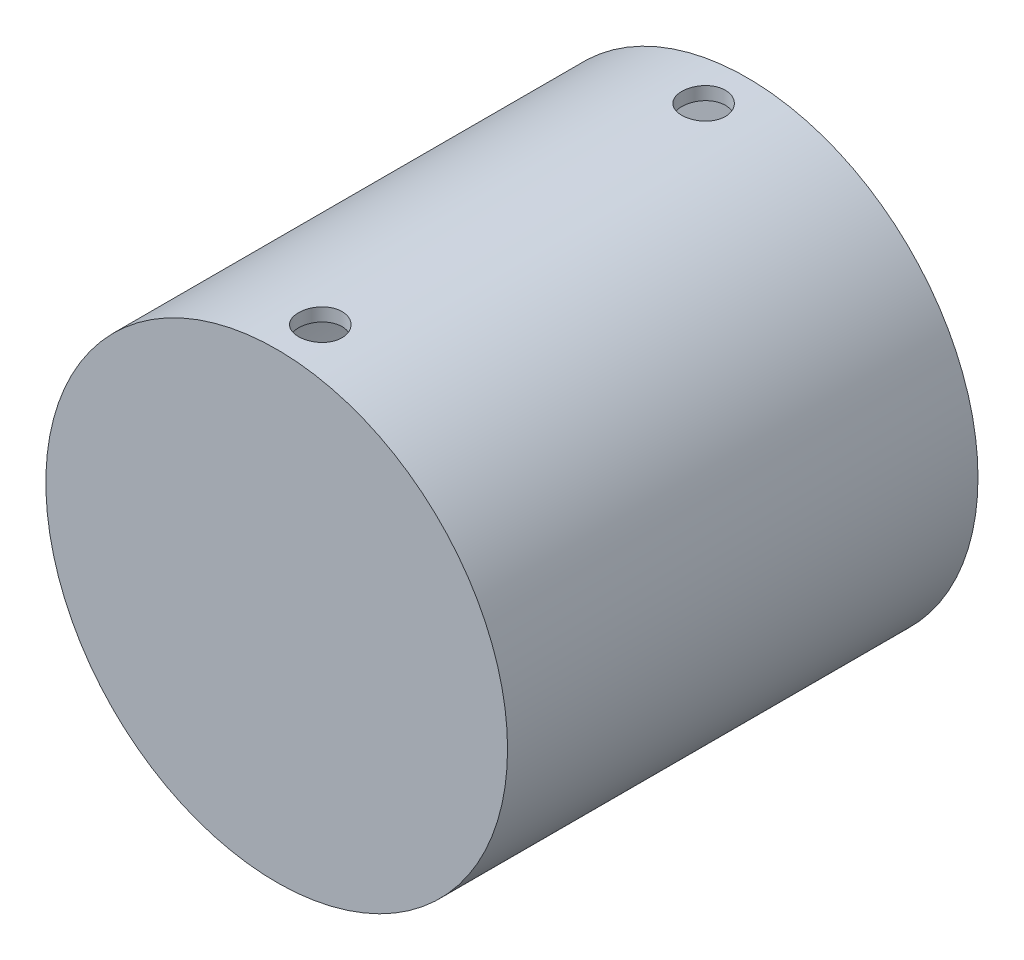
SolidWorks part; units mm, degrees
ref_plane "Front Plane" through (0, 0, 0) normal (0, 0, 1) x (1, 0, 0)
ref_plane "Top Plane" through (0, 0, 0) normal (0, 1, 0) x (1, 0, 0)
ref_plane "Right Plane" through (0, 0, 0) normal (1, 0, 0) x (0, 0, -1)
sketch "Sketch5" plane through (0, 0, 0) normal (0, 0, 1) x (1, 0, 0)
  circle A0 centre (0, 0) radius 50
  circle A1 centre (0, 0) radius 53
  dimension "D1" = 106
  dimension "D2" = 100
extrude "Boss-Extrude5" add sketch "Sketch5" against normal blind 100
sketch "Sketch6" plane through (0, 0, 0) normal (0, 0, 1) x (1, 0, 0)
  circle A0 centre (0, 0) radius 53
extrude "Boss-Extrude6" add sketch "Sketch6" along normal blind 4
ref_plane "Plane3" through (0, 0, -100) normal (0, 0, -1) x (-1, 0, 0)
sketch "Sketch11" plane through (0, 0, -100) normal (0, 0, -1) x (-1, 0, 0)
  circle A0 centre (0, 0) radius 53
  dimension "D1" = 106
extrude "Boss-Extrude9" add sketch "Sketch11" along normal blind 4
sketch "Sketch12" plane through (0, 0, -100) normal (0, 0, -1) x (-1, 0, 0)
  circle A0 centre (0, 0) radius 7.5
  dimension "D1" = 15
extrude "Cut-Extrude4" cut sketch "Sketch12" along normal blind 18
sketch "Sketch13" plane through (0, 0, 0) normal (0, 1, 0) x (1, 0, 0)
  line L0 (55, 100) -> (-55, 100) construction
  circle A0 centre (0, 94) radius 5
  circle A1 centre (0, 6) radius 5
  dimension "D1" = 10
  dimension "D2" = 10
  dimension "D3" = 6
  dimension "D4" = 6
extrude "Cut-Extrude5" cut sketch "Sketch13" along normal blind 92
